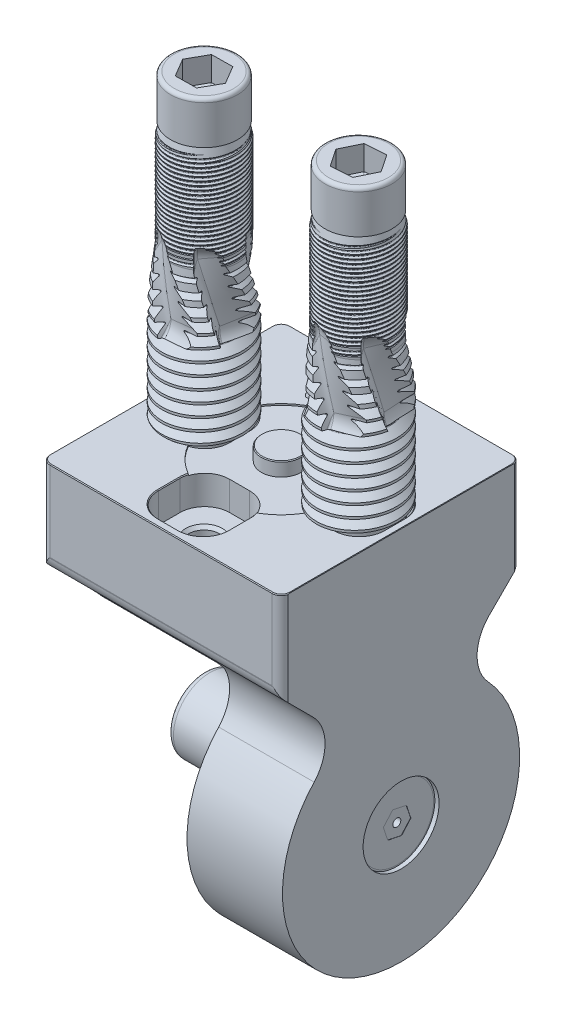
SolidWorks part; units mm, degrees
ref_plane "Front" through (0, 0, 0) normal (0, 0, 1) x (1, 0, 0)
ref_plane "Top" through (0, 0, 0) normal (0, 1, 0) x (1, 0, 0)
ref_plane "Right" through (0, 0, 0) normal (1, 0, 0) x (0, 0, -1)
imported_body "40X65 Pivot_Angle Bracket Stock Ext-15"
imported_body "40-6 Pivot Brackets Bearing ø12mm Bearing Axle"
imported_body "40-6 Pivot Brackets Bearing Socket Countersunk Head Screw"
imported_body "40-6 Pivot Brackets Bearing Face Seal_32.5mm ID"
imported_body "40-6 End Mount Threaded Insert-1"
imported_body "40-6 End Mount Threaded Insert Large Head Reduced Shank SHCS-1"
imported_body "40-6 End Mount Threaded Insert-2"
imported_body "40-6 End Mount Threaded Insert Large Head Reduced Shank SHCS-2"
move or copy body "Body-Move/Copy1" bodies to move or copy 121 119 118 120 114 115 116 117 placed by mates yes
equation "\"Weight kg\"= round ( \"SW-Mass\" , 2 )"
equation "\"Weight lbs\"= round ( \"SW-Mass\" * 2.2046 , 2 )"
